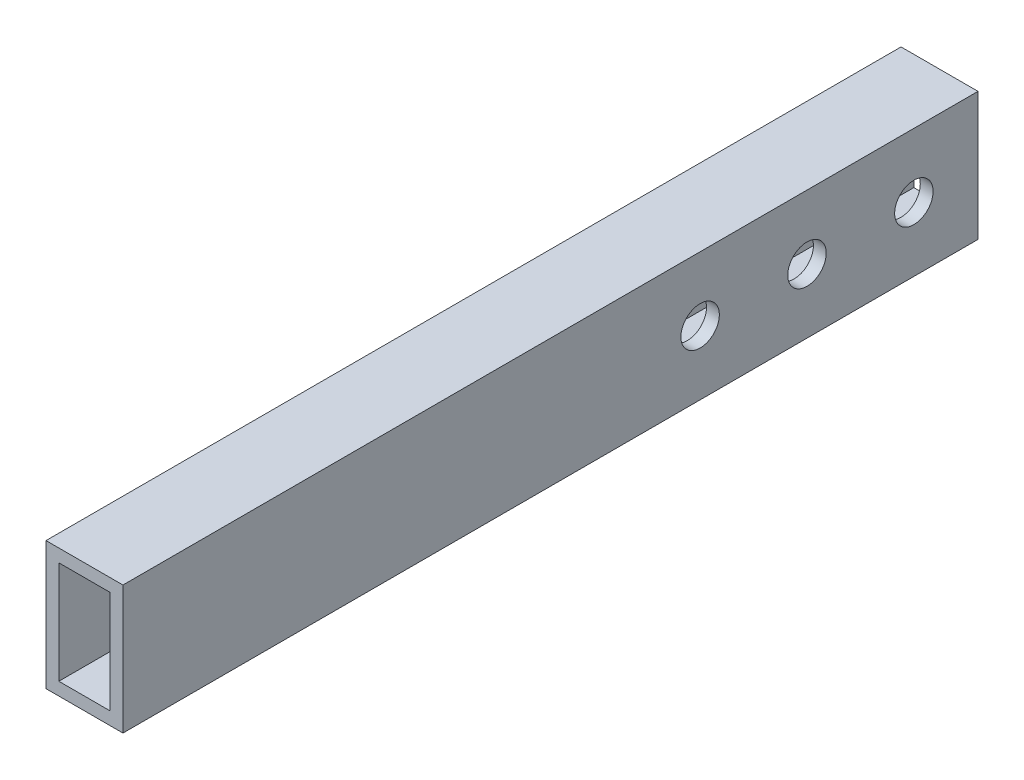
SolidWorks part; units mm, degrees
ref_plane "Plan1" through (0, 0, 0) normal (0, 0, 1) x (1, 0, 0)
ref_plane "Plan2" through (0, 0, 0) normal (0, 1, 0) x (1, 0, 0)
ref_plane "Plan3" through (0, 0, 0) normal (1, 0, 0) x (0, 0, -1)
sketch "Esquisse1" plane through (0, 0, 0) normal (0, 0, 1) x (1, 0, 0)
  line L0 (6, 12) -> (-6, -12) construction
  line L1 (-6, 12) -> (6, 12)
  line L2 (-6, 12) -> (-6, -12)
  line L3 (-6, -12) -> (6, -12)
  line L4 (6, 12) -> (6, -12)
  line L5 (-9, 15) -> (9, 15)
  line L6 (-9, 15) -> (-9, -15)
  line L7 (-9, -15) -> (9, -15)
  line L8 (9, 15) -> (9, -15)
  line L9 (-9, 15) -> (9, -15) construction
  dimension "D1" = 24
  dimension "D2" = 12
  dimension "D3" = 30
  dimension "D4" = 18
extrude "Base-Extrusion" add sketch "Esquisse1" along normal blind 200
hole_wizard "Perçage1" positions "Esquisse3" profile "Esquisse2" hole size "M8" standard "Ansi Métrique"
sketch "Esquisse3" plane through (9, 0, 0) normal (1, 0, 0) x (0, 0, -1)
  line L1 (50, 0) -> (-50, 0) construction
  line L2 (0, -15) -> (0, 15) construction
  point P0 (-15, 0)
  dimension "D1" = 15
sketch "Esquisse2" plane through (9, 0, 15) normal (0, 1, 0) x (0, 0, -1)
  line L0 (0, 0) -> (0, 18)
  line L1 (0, 18) -> (4.5, 18)
  line L2 (4.5, 18) -> (4.5, 0)
  line L5 (4.5, 0) -> (0, 0)
  line L11 (0, -6.35) -> (0, 107.95) construction
  dimension "Diamètre du perçage jusqu'au prochain" = 9
  dimension "Profondeur du perçage jusqu'au prochain" = 18
pattern_linear "Répétition linéaire2" count 3 spacing 25 along (0, 0, 1) of "Perçage1"
